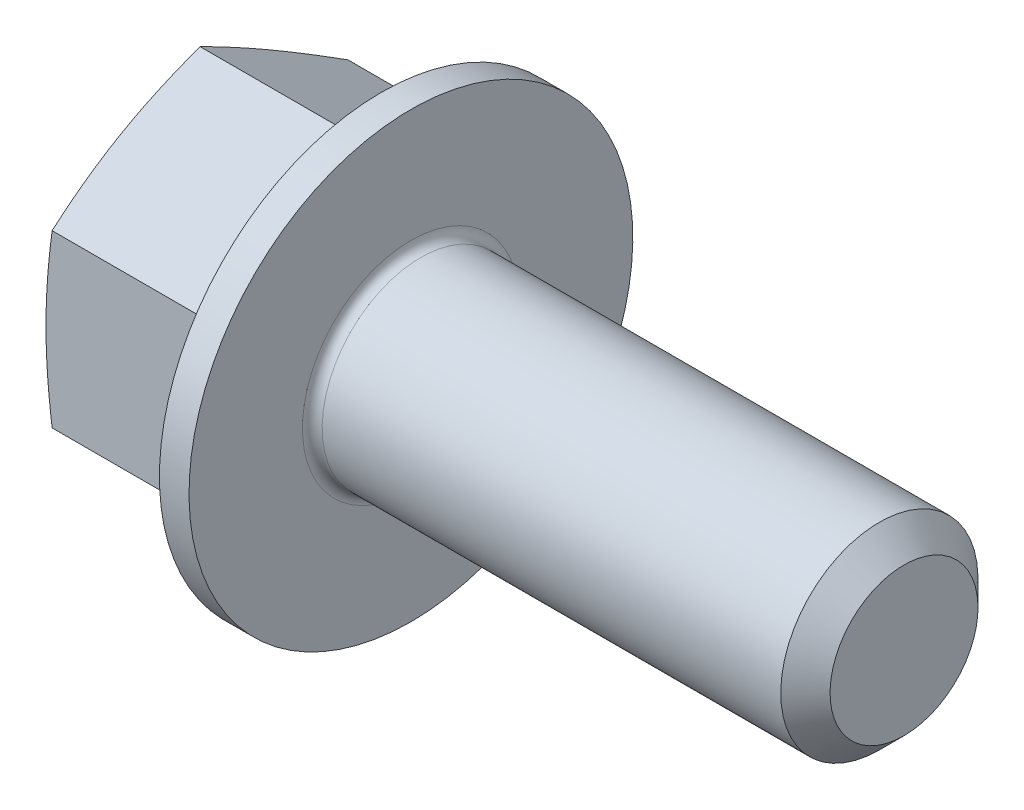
SolidWorks part; units mm, degrees
ref_plane "Front Plane" through (0, 0, 0) normal (0, 0, 1) x (1, 0, 0)
ref_plane "Top Plane" through (0, 0, 0) normal (0, 1, 0) x (1, 0, 0)
ref_plane "Right Plane" through (0, 0, 0) normal (1, 0, 0) x (0, 0, -1)
sketch "Sketch1" plane through (0, 0, 0) normal (0, 0, 1) x (1, 0, 0)
  line L0 (0, 0) -> (5, 0) construction
  line L1 (0, 0) -> (-2.2, 0) construction
  line L2 (0.1, 1) -> (4.75, 1)
  line L3 (5, 0) -> (5, 0.75)
  line L4 (0, 1.1) -> (0, 2.25)
  line L5 (0, 2.25) -> (-0.3, 2.25)
  line L6 (-0.3, 2.25) -> (-0.501, 1.5)
  line L7 (-0.501, 1.5) -> (-2.2, 1.5)
  line L8 (-2.2, 1.5) -> (-2.2, 1.2)
  line L9 (-2.2, 1.2) -> (-1.925, 1.2)
  line L10 (-1.925, 1.2) -> (-1.925, 0)
  line L11 (-1.925, 0) -> (5, 0)
  line L12 (-1.925, 0) -> (-1.925, 1.58) construction
  line L14 (5, 0.75) -> (4.75, 1)
  line L15 (5, 0) -> (0.4, 0) construction
  arc A0 (0.1, 1) -> (0, 1.1) centre (0.1, 1.1) cw
  dimension "D7" = 0.1
  dimension "D1" = 2.4
  dimension "L" = 5
  dimension "D2" = 0.275
  dimension "K" = 2.2
  dimension "s" = 3
  dimension "dia" = 2
  dimension "c" = 0.3
  dimension "D4" = 15
  dimension "D5" = 45
  dimension "min" = 1.5
  dimension "B" = 4.6
  dimension "Dc" = 4.5
revolve "Revolve1" add sketch "Sketch1" angle 360 about L11
sketch "Sketch2" plane through (-2.2, 0, 0) normal (-1, 0, 0) x (0, 0, 1)
  line L1 (0, 1.7321) -> (-1.5, 0.866)
  line L2 (-1.5, 0.866) -> (-1.5, -0.866)
  line L3 (-1.5, -0.866) -> (0, -1.7321)
  line L4 (0, -1.7321) -> (1.5, -0.866)
  line L5 (1.5, -0.866) -> (1.5, 0.866)
  line L6 (1.5, 0.866) -> (0, 1.7321)
  circle A0 centre (0, 0) radius 1.2 construction
  circle A1 centre (0, 0) radius 1.2
  circle A2 centre (0, 0) radius 1.5 construction
  circle A3 centre (0, 0) radius 1.5 construction
extrude "Extrude1" add sketch "Sketch2" against normal up to next
sketch "Sketch3" plane through (0, 0, 0) normal (0, 1, 0) x (1, 0, 0)
  line L0 (-2.401, 0.75) -> (-1.999, 2.25)
  line L1 (-2.2, 0) -> (-2.2, 1.5) construction
  line L2 (0, 0) -> (-3.6033, 0) construction
  line L3 (-1.999, 2.25) -> (-2.401, 2.25)
  line L4 (-2.401, 2.25) -> (-2.401, 0.75)
  dimension "D1" = 15
  dimension "D2" = 1.5
revolve "Cut-Revolve1" cut sketch "Sketch3" angle 360 about L2
fillet "Fillet1" radius 0.1 6 edges
sketch "Sketch4" plane through (0, 0, 0) normal (0, 0, 1) x (1, 0, 0)
  line L0 (0, 0) -> (5.3731, 0) construction
  line L1 (5, -0.75) -> (5, 0.75) construction
  line L3 (5, 0.665) -> (4.1912, 1)
  line L4 (0.1, 1) -> (4.75, 1) construction
  line L5 (4.1912, 1) -> (4.1912, 1.5)
  line L6 (4.1912, 1.5) -> (5, 1.5)
  line L7 (5, 1.5) -> (5, 0.665)
  dimension "D1" = 0.5
  dimension "D2" = 22.5
  dimension "Dp" = 1.33
revolve "Cut-Revolve2" [suppressed] cut sketch "Sketch4" angle 360 about L0
sketch "Sketch5" plane through (0, 0, 0) normal (0, 0, 1) x (1, 0, 0)
  line L0 (5, 0) -> (0.75, 0) construction
  line L1 (-1.925, 0) -> (5, 0) construction
  line L2 (0.8943, 0.75) -> (1.0387, 1)
  line L3 (1.0387, 1) -> (1.0387, 1.2887)
  line L4 (1.0387, 1.2887) -> (0.75, 1.2887)
  line L5 (0.75, 1.2887) -> (0.75, 1)
  line L6 (0.75, 1) -> (0.8943, 0.75)
  dimension "D1" = 1.5
  dimension "B" = 4.25
  dimension "D2" = 2
revolve "Cut-Revolve10" [suppressed] cut sketch "Sketch5" angle 360 about L0
pattern_linear "LPattern10" [suppressed] count 11 spacing 0.4 along (-1, 0, 0)
equation "\"D1@Sketch1\" = \"s@Sketch1\" / 10 * 8"
equation "\"D2@Sketch1\" = \"K@Sketch1\" / 8"
equation "\"D2@Sketch3\" = \"s@Sketch1\" / 2"
equation "\"D2@Cosmetic Thread1\" = \"min@Sketch1\""
equation "\"D1@Cosmetic Thread1\" = \"B@Sketch1\" -  ( \"dia@Sketch1\" - \"min@Sketch1\" )  / 2 - \"D7@Sketch1\""
equation "\"D1@Sketch5\" = \"D2@Cosmetic Thread1\""
equation "\"D2@Sketch5\" = \"dia@Sketch1\""
equation "\"B@Sketch5\" = \"D1@Cosmetic Thread1\""
equation "\"D1@LPattern10\" = int( \"D1@Cosmetic Thread1\" / \"D3@LPattern10\" + 0.999 ) "
